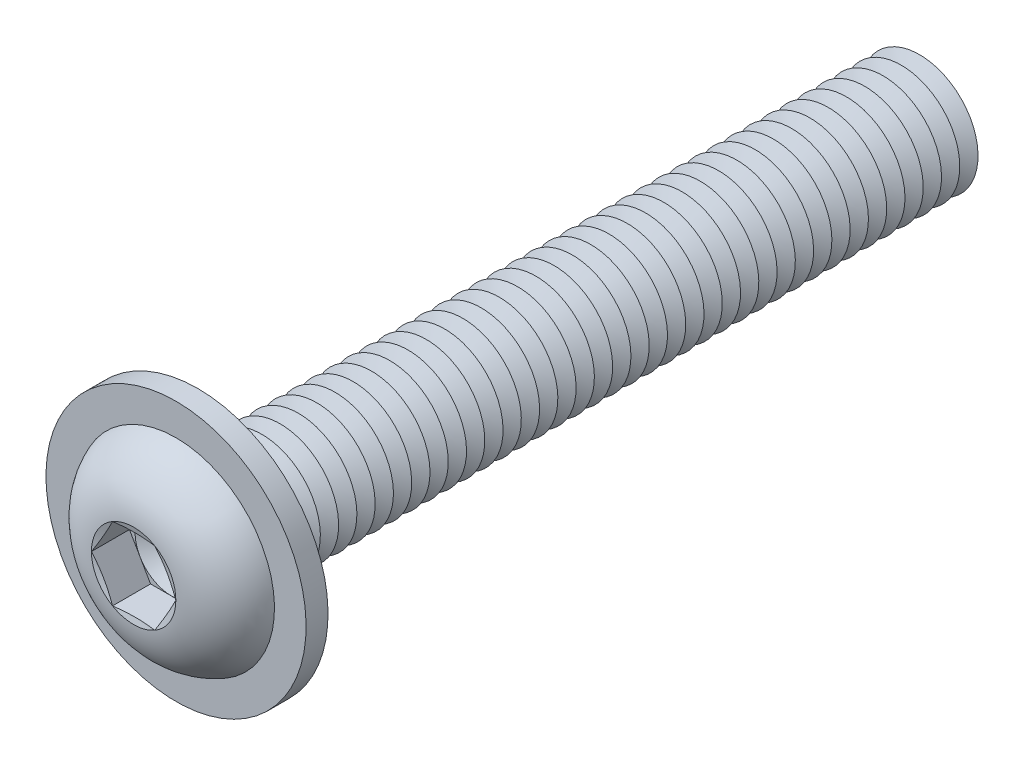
SolidWorks part; units mm, degrees
ref_plane "Front Plane" through (0, 0, 0) normal (0, 0, 1) x (1, 0, 0)
ref_plane "Top Plane" through (0, 0, 0) normal (0, 1, 0) x (1, 0, 0)
ref_plane "Right Plane" through (0, 0, 0) normal (1, 0, 0) x (0, 0, -1)
sketch "Sketch1" plane through (0, 0, 0) normal (1, 0, 0) x (0, 0, -1)
  line L0 (0, 4) -> (0, 7)
  line L3 (0, 4) -> (50, 4)
  line L4 (50, 4) -> (50, 0)
  line L5 (50, 0) -> (-4.4, 0) construction
  line L6 (-4.4, 0) -> (50, 0)
  line L7 (-4.4, 2.8867) -> (-4.4, 1.4434) construction
  line L8 (-4.4, 1.4434) -> (-4.4, 0)
  line L9 (-4.4, 2.8867) -> (-4.0132, 1.4434)
  line L10 (-4.0132, 1.4434) -> (-4.4, 1.4434)
  line L11 (50, 0) -> (22.7481, 0) construction
  line L12 (0, 7) -> (-4.4, 7) construction
  arc A1 (0, 7) -> (-4.4, 2.8867) centre (0, 2.59) ccw
  point P8 (50, 2)
  dimension "D1" = 14
  dimension "D2" = 8
  dimension "D3" = 4.4
  dimension "D4" = 5.7735
  dimension "D5" = 50
  dimension "D6" = 15
revolve "Revolve1" add sketch "Sketch1" angle 360 about L5
fillet "Fillet1" radius 0.625 1 edges at (0, 4, 0)
sketch "Sketch2" plane through (0, 0, 0) normal (1, 0, 0) x (0, 0, -1)
  line L0 (49.375, 4) -> (50.625, 4)
  line L1 (50, 4) -> (0.625, 4) construction
  line L2 (50.625, 4) -> (50, 2.9175)
  line L3 (50, -4) -> (50, 4) construction
  line L4 (50, 2.9175) -> (49.375, 4)
  dimension "D1" = 1.25
revolve "Cut-Revolve1" cut sketch "Sketch2" angle 360 about axis through (0, 0, -50) along (0, 0, -1)
pattern_linear "LPattern1" count 40 spacing 1.25 along (0, 0, 1) of "Cut-Revolve1"
sketch "Sketch3" plane through (0, 0, 4.4) normal (0, 0, 1) x (1, 0, 0)
  line L7 (1.4434, 2.5) -> (-1.4434, 2.5)
  line L8 (-1.4434, 2.5) -> (-2.8867, 0)
  line L9 (-2.8867, 0) -> (-1.4434, -2.5)
  line L10 (-1.4434, -2.5) -> (1.4434, -2.5)
  line L11 (1.4434, -2.5) -> (2.8867, 0)
  line L12 (2.8867, 0) -> (1.4434, 2.5)
  circle A0 centre (0, 0) radius 2.5 construction
  circle A3 centre (0, 0) radius 2.8867 construction
extrude "Cut-Extrude1" cut sketch "Sketch3" against normal blind 2.6
sketch "Sketch4" plane through (0, 0, 1.8) normal (0, 0, 1) x (1, 0, 0)
  line L1 (1.4434, 2.5) -> (-1.4434, 2.5) construction
  circle A0 centre (0, 0) radius 2.5
extrude "Cut-Extrude2" cut sketch "Sketch4" against normal through all draft 60
sketch "Sketch5" plane through (0, 0, 0) normal (0, 0, -1) x (-1, 0, 0)
  circle A0 centre (0, 0) radius 8.9
  circle A1 centre (0, 0) radius 4.625
  circle A2 centre (0, 0) radius 4.625 construction
  dimension "D1" = 17.8
extrude "Boss-Extrude1" add sketch "Sketch5" against normal blind 1.5
